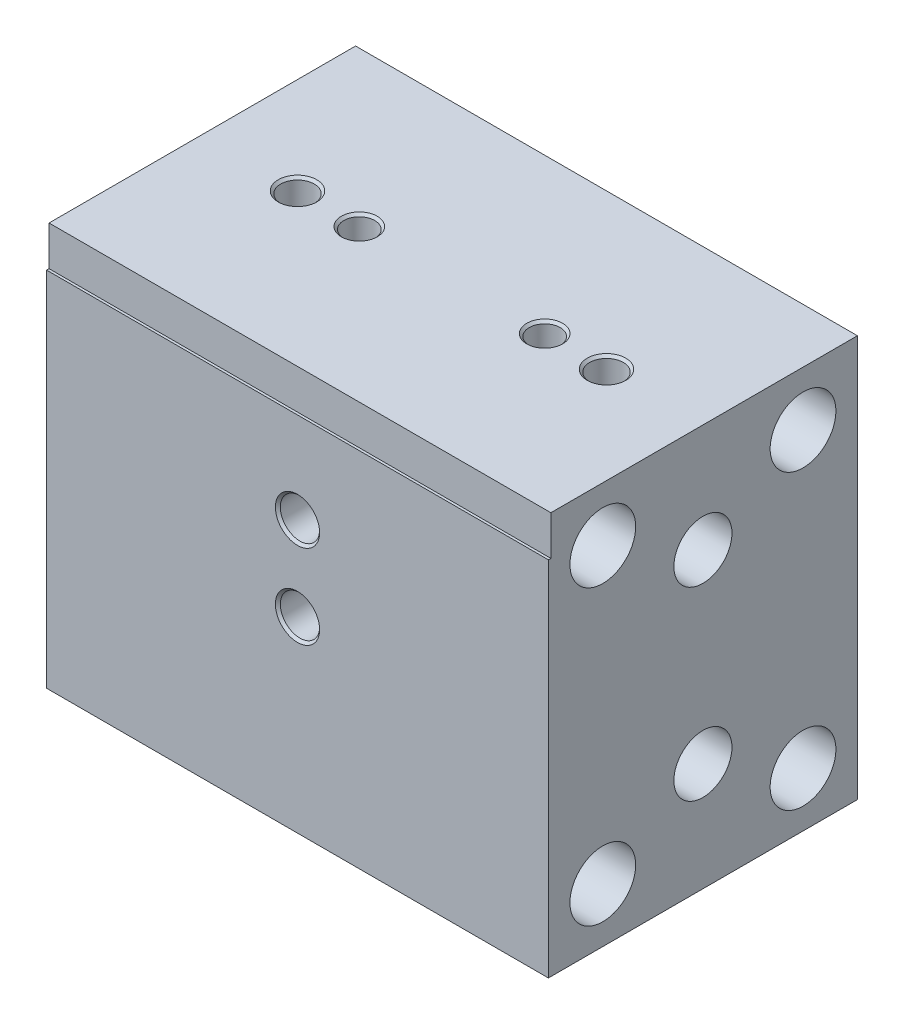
SolidWorks part; units mm, degrees
ref_plane "Front Plane" through (0, 0, 0) normal (0, 0, 1) x (1, 0, 0)
ref_plane "Top Plane" through (0, 0, 0) normal (0, 1, 0) x (1, 0, 0)
ref_plane "Right Plane" through (0, 0, 0) normal (1, 0, 0) x (0, 0, -1)
sketch "Sketch1" plane through (0, 0, 0) normal (0, 0, 1) x (1, 0, 0)
  line L0 (-25.781, -20.6375) -> (25.781, -20.6375)
  line L1 (25.781, -20.6375) -> (25.781, 20.6375)
  line L2 (25.781, 20.6375) -> (-25.781, 20.6375)
  line L3 (-25.781, 20.6375) -> (-25.781, -20.6375)
  line L4 (-25.781, 20.6375) -> (25.781, -20.6375) construction
  dimension "D1" = 51.562
  dimension "D2" = 41.275
extrude "Extrude1" add sketch "Sketch1" along normal mid plane 31.75
sketch "Sketch18" plane through (25.781, 0, 0) normal (1, 0, 0) x (0, 0, -1)
  line L0 (-15.875, 20.6375) -> (-15.875, 16.5735)
  line L1 (-15.875, 16.5735) -> (-15.621, 16.5735)
  line L2 (-15.621, 16.5735) -> (-15.621, 20.6375)
  line L3 (-15.621, 20.6375) -> (-15.875, 20.6375)
  line L4 (-15.875, 20.6375) -> (15.875, 20.6375) construction
  line L5 (-15.875, -20.6375) -> (-15.875, 20.6375) construction
  dimension "D1" = 4.064
  dimension "D2" = 0.254
extrude "Cut-Extrude1" cut sketch "Sketch18" against normal blind 51.562
hole_wizard "#8-32 Tapped Hole1" positions "Sketch20" profile "Sketch19" tap size "#8-32" standard "ANSI Inch"
sketch "Sketch20" plane through (0, 20.6375, 0) normal (0, 1, 0) x (1, 0, 0)
  line L0 (-15.875, 0) -> (15.875, 0) construction
  point P0 (-15.875, 0)
  point P2 (15.875, 0)
  dimension "D1" = 31.75
sketch "Sketch19" plane through (-15.875, 20.6375, 0) normal (1, 0, 0) x (0, 0, 1)
  line L0 (0, 0) -> (0, 11.3502)
  line L1 (0, 11.3502) -> (1.7272, 10.3124)
  line L2 (1.7272, 10.3124) -> (1.7272, 0)
  line L5 (1.7272, 0) -> (0, 0)
  line L10 (0, 11.3502) -> (-1.7272, 10.3124) construction
  line L11 (0, -6.35) -> (0, 107.95) construction
  dimension "Tap Drill Dia." = 3.4544
  dimension "Tap Drill Depth" = 10.3124
  dimension "Drill Angle" = 118
hole_wizard "Hole1" positions "Sketch22" profile "Sketch21" legacy
sketch "Sketch22" plane through (0, 20.6375, 0) normal (0, 1, 0) x (1, 0, 0)
  line L0 (-9.525, 0) -> (9.525, 0) construction
  point P0 (-9.525, 0)
  point P2 (9.525, 0)
  dimension "D1" = 19.05
sketch "Sketch21" plane through (-9.525, 20.6375, 0) normal (1, 0, 0) x (0, 0, 1)
  line L0 (0, 0) -> (0, 7.3039)
  line L1 (0, 7.3039) -> (1.5875, 6.35)
  line L2 (1.5875, 6.35) -> (1.5875, 0)
  line L4 (1.5875, 0) -> (0, 0)
  line L6 (0, 7.3039) -> (-1.5875, 6.35) construction
  line L7 (0, -4.2442) -> (0, 117.3081) construction
  dimension "Diameter" = 3.175
  dimension "Depth" = 6.35
  dimension "Drill Angle" = 118
hole_wizard "#10-32 Tapped Hole1" positions "Sketch24" profile "Sketch23" tap size "#10-32" standard "ANSI Inch"
sketch "Sketch24" plane through (0, 0, 15.875) normal (0, 0, 1) x (1, 0, 0)
  point P0 (0, 7.239)
  point P2 (0, -1.397)
  dimension "D1" = 8.636
  dimension "D2" = 1.397
sketch "Sketch23" plane through (0, 7.239, 15.875) normal (1, 0, 0) x (0, -1, 0)
  line L0 (0, 0) -> (0, 10.7637)
  line L1 (0, 10.7637) -> (2.0193, 9.5504)
  line L2 (2.0193, 9.5504) -> (2.0193, 0)
  line L5 (2.0193, 0) -> (0, 0)
  line L10 (0, 10.7637) -> (-2.0193, 9.5504) construction
  line L11 (0, -6.35) -> (0, 107.95) construction
  dimension "Tap Drill Dia." = 4.0386
  dimension "Tap Drill Depth" = 9.5504
  dimension "Drill Angle" = 118
hole_wizard "#8-32 Tapped Hole2" positions "Sketch26" profile "Sketch25" tap size "#8-32" standard "ANSI Inch"
sketch "Sketch26" plane through (0, 0, -15.875) normal (0, 0, -1) x (-1, 0, 0)
  line L0 (-15.875, 0) -> (15.875, 0) construction
  point P0 (-15.875, 0)
  point P2 (15.875, 0)
  dimension "D1" = 31.75
sketch "Sketch25" plane through (15.875, 0, -15.875) normal (1, 0, 0) x (0, 1, 0)
  line L0 (0, 0) -> (0, 11.3502)
  line L1 (0, 11.3502) -> (1.7272, 10.3124)
  line L2 (1.7272, 10.3124) -> (1.7272, 0)
  line L5 (1.7272, 0) -> (0, 0)
  line L10 (0, 11.3502) -> (-1.7272, 10.3124) construction
  line L11 (0, -6.35) -> (0, 107.95) construction
  dimension "Tap Drill Dia." = 3.4544
  dimension "Tap Drill Depth" = 10.3124
  dimension "Drill Angle" = 118
hole_wizard "Hole2" positions "Sketch28" profile "Sketch27" legacy
sketch "Sketch28" plane through (0, 0, -15.875) normal (0, 0, -1) x (-1, 0, 0)
  line L0 (-9.525, 0) -> (9.525, 0) construction
  point P0 (-9.525, 0)
  point P2 (9.525, 0)
  dimension "D1" = 19.05
sketch "Sketch27" plane through (9.525, 0, -15.875) normal (1, 0, 0) x (0, 1, 0)
  line L0 (0, 0) -> (0, 7.3039)
  line L1 (0, 7.3039) -> (1.5875, 6.35)
  line L2 (1.5875, 6.35) -> (1.5875, 0)
  line L4 (1.5875, 0) -> (0, 0)
  line L6 (0, 7.3039) -> (-1.5875, 6.35) construction
  line L7 (0, -4.2442) -> (0, 117.3081) construction
  dimension "Diameter" = 3.175
  dimension "Depth" = 6.35
  dimension "Drill Angle" = 118
sketch "Sketch29" plane through (25.781, 0, 0) normal (1, 0, 0) x (0, 0, -1)
  line L0 (-10.287, 15.0495) -> (10.287, -15.0495) construction
  line L1 (0, 9.525) -> (0, -9.525) construction
  circle A0 centre (-10.287, 15.0495) radius 3.3782
  circle A1 centre (10.287, 15.0495) radius 3.3782
  circle A2 centre (-10.287, -15.0495) radius 3.3782
  circle A3 centre (10.287, -15.0495) radius 3.3782
  circle A4 centre (0, 9.525) radius 2.9845
  circle A5 centre (0, -9.525) radius 2.9845
  dimension "D1" = 30.099
  dimension "D2" = 20.574
  dimension "D3" = 6.7564
  dimension "D4" = 5.969
  dimension "D5" = 19.05
extrude "Cut-Extrude2" cut sketch "Sketch29" against normal through all
chamfer "Chamfer1" distance 0.254 angle 45 10 edges at (-17.6022, 0, -15.875) (-11.1125, 0, -15.875) (7.9375, 0, -15.875) (14.1478, 0, -15.875) (2.0193, -1.397, 15.875) (2.0193, 7.239, 15.875) (15.875, 20.6375, 1.7272) (9.525, 20.6375, 1.5875) (-9.525, 20.6375, 1.5875) (-15.875, 20.6375, 1.7272)
